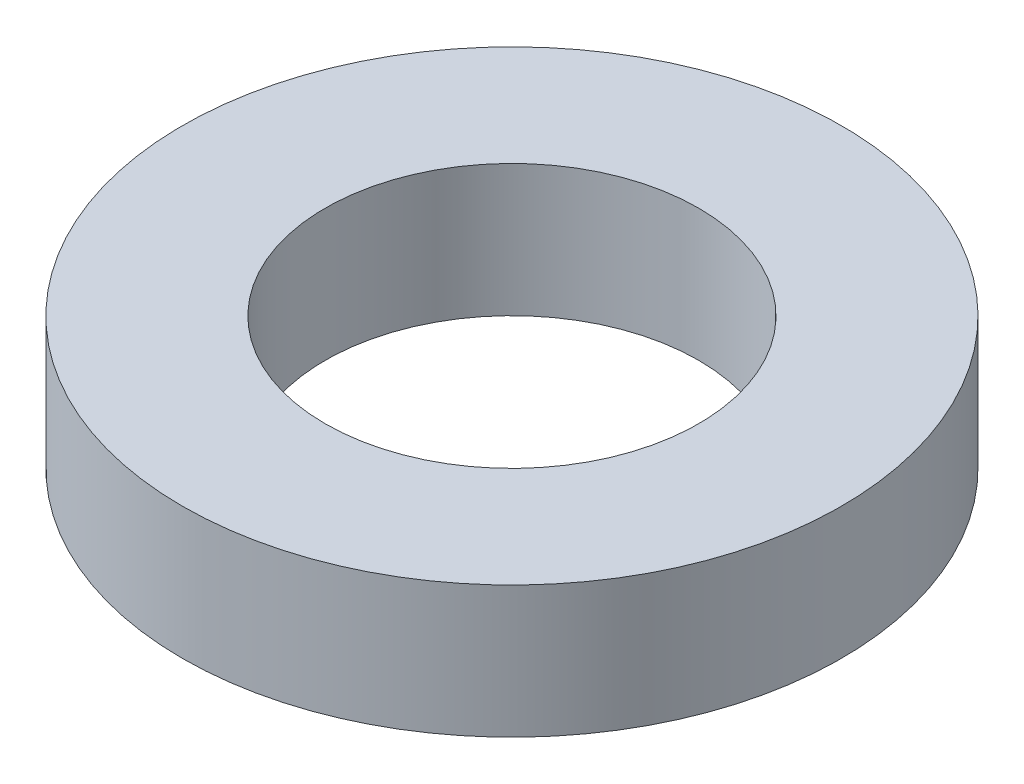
SolidWorks part; units mm, degrees
ref_plane "Alzado" through (0, 0, 0) normal (0, 0, 1) x (1, 0, 0)
ref_plane "Planta" through (0, 0, 0) normal (0, 1, 0) x (1, 0, 0)
ref_plane "Vista lateral" through (0, 0, 0) normal (1, 0, 0) x (0, 0, -1)
sketch "Sketch1" plane through (0, 0, 0) normal (0, 1, 0) x (1, 0, 0)
  circle A0 centre (0, 0) radius 4.25
  circle A1 centre (0, 0) radius 7.5
  dimension "D1" = 8.5
  dimension "D2" = 15
extrude "Boss-Extrude1" add sketch "Sketch1" along normal blind 3
